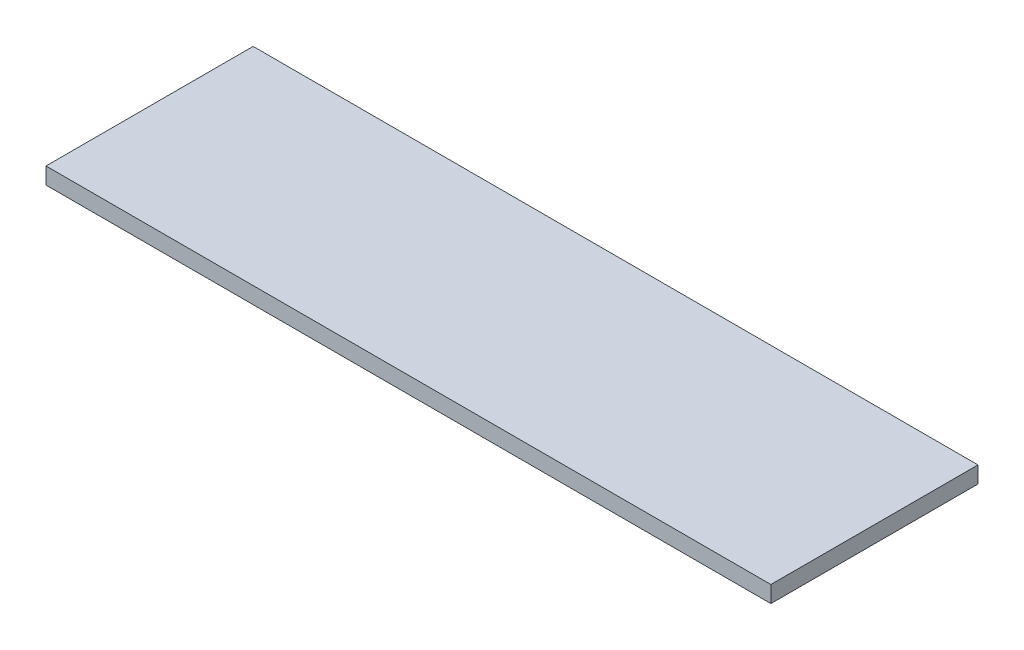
SolidWorks part; units mm, degrees
ref_plane "Front Plane" through (0, 0, 0) normal (0, 0, 1) x (1, 0, 0)
ref_plane "Top Plane" through (0, 0, 0) normal (0, 1, 0) x (1, 0, 0)
ref_plane "Right Plane" through (0, 0, 0) normal (1, 0, 0) x (0, 0, -1)
sketch "Sketch1" plane through (0, 0, 0) normal (0, 1, 0) x (1, 0, 0)
  line L1 (-44.45, 12.7) -> (44.45, 12.7)
  line L2 (-44.45, 12.7) -> (-44.45, -12.7)
  line L3 (-44.45, -12.7) -> (44.45, -12.7)
  line L4 (44.45, 12.7) -> (44.45, -12.7)
  line L5 (-44.45, 12.7) -> (44.45, -12.7) construction
  line L6 (-44.45, -12.7) -> (44.45, 12.7) construction
  point P0 (0, 0)
  dimension "D1" = 25.4
  dimension "D2" = 88.9
extrude "Boss-Extrude1" add sketch "Sketch1" along normal blind 2.032
